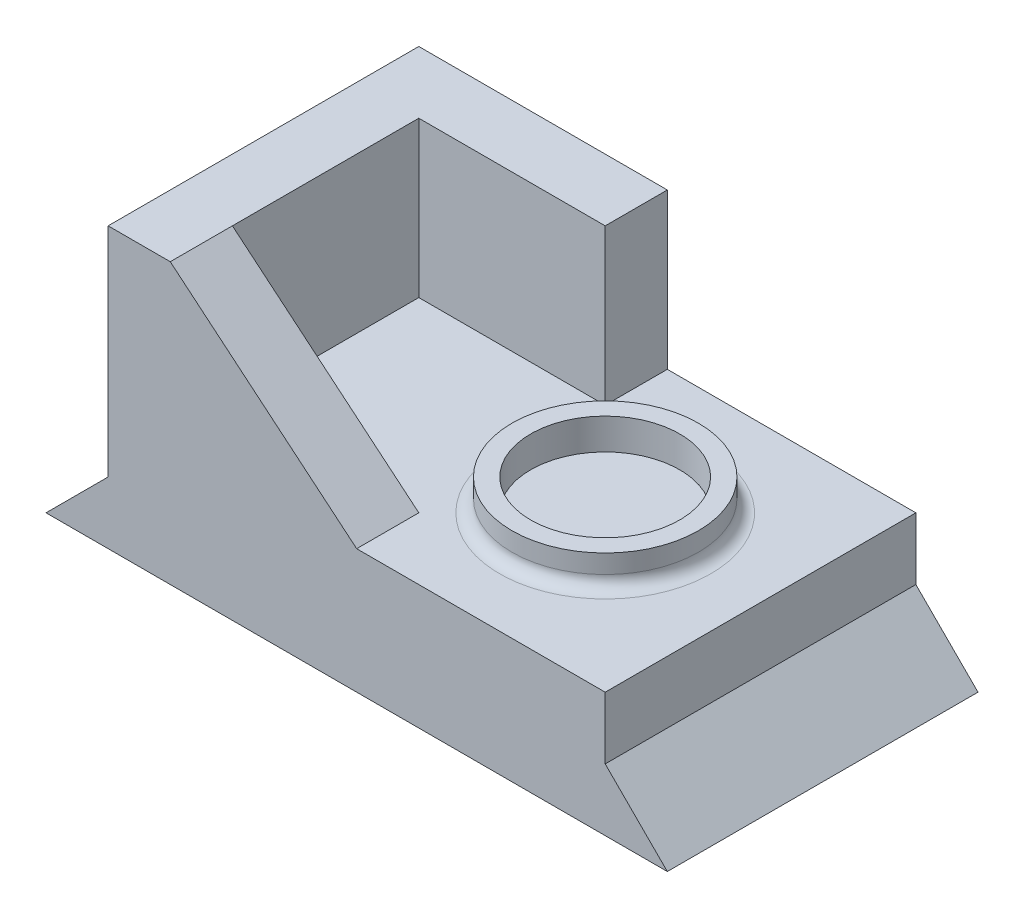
SolidWorks part; units mm, degrees
ref_plane "Front Plane" through (0, 0, 0) normal (0, 0, 1) x (1, 0, 0)
ref_plane "Top Plane" through (0, 0, 0) normal (0, 1, 0) x (1, 0, 0)
ref_plane "Right Plane" through (0, 0, 0) normal (1, 0, 0) x (0, 0, -1)
sketch "Esquisse1" plane through (0, 0, 0) normal (0, 0, 1) x (1, 0, 0)
  line L0 (51.416, 0) -> (-48.584, 0)
  line L1 (-48.584, 0) -> (-38.584, 10)
  line L2 (-38.584, 10) -> (-38.584, 45)
  line L3 (-38.584, 45) -> (-28.584, 45)
  line L6 (41.416, 20) -> (41.416, 10)
  line L7 (41.416, 10) -> (51.416, 0)
  line L8 (-28.584, 45) -> (1.416, 20)
  line L9 (1.416, 20) -> (41.416, 20)
  dimension "D1" = 100
  dimension "D2" = 10
  dimension "D3" = 10
  dimension "D4" = 45
  dimension "D5" = 10
  dimension "D6" = 30
  dimension "D7" = 10
  dimension "D8" = 25
  dimension "D9" = 10
  dimension "D10" = 80
  dimension "D11" = 10
extrude "Boss.-Extru.1" add sketch "Esquisse1" along normal mid plane 50
sketch "Esquisse2" plane through (0, 0, -25) normal (0, 0, -1) x (-1, 0, 0)
  line L1 (-1.416, 20) -> (28.584, 45)
  line L2 (-1.416, 20) -> (-1.416, 45)
  line L3 (-1.416, 45) -> (28.584, 45)
  line L4 (28.584, 45) -> (38.584, 45) construction
  line L5 (-1.416, 20) -> (28.584, 45) construction
extrude "Boss.-Extru.3" add sketch "Esquisse2" against normal blind 10
sketch "Esquisse3" plane through (0, 20, 0) normal (0, 1, 0) x (1, 0, 0)
  circle A0 centre (16.416, 0) radius 15
  circle A1 centre (16.416, 0) radius 12
  dimension "D1" = 30
  dimension "D2" = 24
  dimension "D3" = 25
  dimension "D4" = 35
extrude "Boss.-Extru.4" add sketch "Esquisse3" along normal blind 5
sketch "Esquisse4" plane through (0, 45, 0) normal (0, 1, 0) x (1, 0, 0)
  line L0 (1.416, -25) -> (1.416, 0) construction
  line L1 (-28.584, 15) -> (1.416, 15)
  line L2 (-28.584, 15) -> (-28.584, -15)
  line L3 (-28.584, -15) -> (1.416, -15)
  line L4 (1.416, 15) -> (1.416, -15)
  dimension "D1" = 30
  dimension "D2" = 30
extrude "Enlèv. mat.-Extru.1" cut sketch "Esquisse4" against normal up to surface (25 mm away)
fillet "Congé2" radius 2 1 edges at (16.416, 20, 15)
